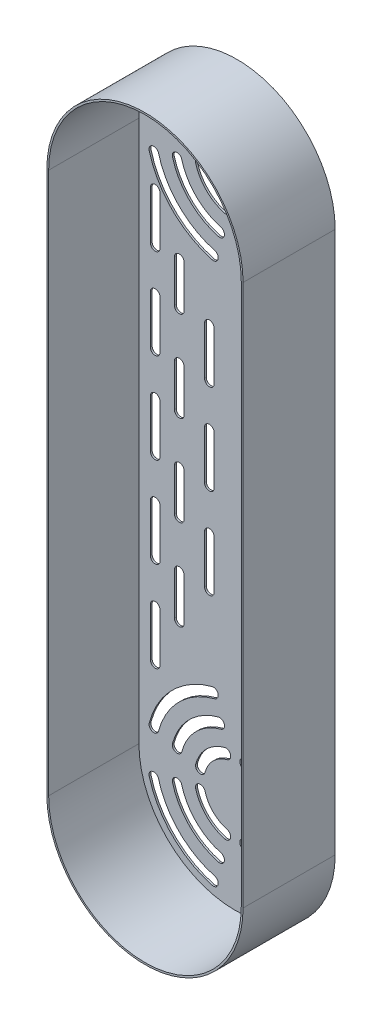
SolidWorks part; units mm, degrees
ref_plane "Front Plane" through (0, 0, 0) normal (0, 0, 1) x (1, 0, 0)
ref_plane "Top Plane" through (0, 0, 0) normal (0, 1, 0) x (1, 0, 0)
ref_plane "Right Plane" through (0, 0, 0) normal (1, 0, 0) x (0, 0, -1)
sketch "Sketch1" plane through (0, 0, 0) normal (0, 0, 1) x (1, 0, 0)
  line L0 (-163, 0) -> (163, 0) construction
  line L1 (-160, 900) -> (-160, 0)
  line L2 (160, 900) -> (160, 0)
  line L3 (-163, 900) -> (-163, 0)
  line L4 (163, 900) -> (163, 0)
  line L5 (163, 900) -> (-163, 900) construction
  line L6 (0, 900) -> (0, 0) construction
  arc A0 (163, 900) -> (-163, 900) centre (0, 900) ccw
  arc A1 (-160, 0) -> (160, 0) centre (0, 0) ccw
  arc A2 (160, 900) -> (-160, 900) centre (0, 900) ccw
  arc A3 (-163, 0) -> (163, 0) centre (0, 0) ccw
  dimension "D1" = 3
  dimension "D2" = 900
  dimension "D3" = 160
extrude "Boss-Extrude1" add sketch "Sketch1" along normal blind 150 contours L3 A3 L4 A0 | A1 L2 A2 L1
sketch "Sketch2" plane through (0, 0, 0) normal (0, 0, -1) x (-1, 0, 0)
  line L0 (0, 0) -> (-163, 0) construction
  line L1 (0, 900) -> (-163, 900) construction
  line L2 (-163, 0) -> (-163, 900)
  line L3 (0, 0) -> (0, 900) construction
  line L4 (163, 0) -> (163, 900)
  arc A0 (-163, 0) -> (163, 0) centre (0, 0) ccw
  arc A1 (163, 900) -> (-163, 900) centre (0, 900) ccw
  arc A2 (163, 900) -> (-163, 900) centre (0, 900) ccw construction
  arc A3 (-163, 0) -> (163, 0) centre (0, 0) ccw construction
extrude "Boss-Extrude2" add sketch "Sketch2" along normal blind 3
sketch "Sketch3" plane through (0, 0, 0) normal (0, 0, 1) x (1, 0, 0)
  line L0 (135.2296, -36.2347) -> (0, 0) construction
  line L1 (36.2347, -135.2296) -> (0, 0) construction
  line L2 (55, 0) -> (-55, 0) construction
  line L3 (0, -55) -> (0, 55) construction
  arc A0 (135.2296, -36.2347) -> (36.2347, -135.2296) centre (0, 0) cw construction
  arc A1 (38.3052, -142.957) -> (142.957, -38.3052) centre (0, 0) ccw
  arc A2 (34.1641, -127.5022) -> (127.5022, -34.1641) centre (0, 0) ccw
  arc A3 (34.1641, -127.5022) -> (38.3052, -142.957) centre (36.2347, -135.2296) ccw
  arc A4 (142.957, -38.3052) -> (127.5022, -34.1641) centre (135.2296, -36.2347) ccw
  arc A5 (25.8819, -96.5926) -> (96.5926, -25.8819) centre (0, 0) ccw construction
  arc A6 (27.9525, -104.32) -> (104.32, -27.9525) centre (0, 0) ccw
  arc A7 (23.8114, -88.8652) -> (88.8652, -23.8114) centre (0, 0) ccw
  arc A8 (23.8114, -88.8652) -> (27.9525, -104.32) centre (25.8819, -96.5926) ccw
  arc A9 (104.32, -27.9525) -> (88.8652, -23.8114) centre (96.5926, -25.8819) ccw
  arc A10 (57.9555, -15.5291) -> (15.5291, -57.9555) centre (0, 0) cw construction
  arc A11 (17.5997, -65.683) -> (65.683, -17.5997) centre (0, 0) ccw
  arc A12 (13.4586, -50.2281) -> (50.2281, -13.4586) centre (0, 0) ccw
  arc A13 (13.4586, -50.2281) -> (17.5997, -65.683) centre (15.5291, -57.9555) ccw
  arc A14 (65.683, -17.5997) -> (50.2281, -13.4586) centre (57.9555, -15.5291) ccw
  point P4 (98.9949, -98.9949)
  point P9 (70.7107, -70.7107)
  point P22 (42.4264, -42.4264)
  dimension "D1" = 140
  dimension "D2" = 100
  dimension "D3" = 60
  dimension "D4" = 8
  dimension "D5" = 15
  dimension "D6" = 15
extrude "Cut-Extrude1" cut sketch "Sketch3" against normal blind 10 contours A6 A9 A7 A8 | A1 A4 A2 A3 | A11 A14 A12 A13
pattern_circular "CirPattern1" count 4 over 360 about axis through (0, 0, 0) along (0, 0, 1) of "Cut-Extrude1"
pattern_linear "LPattern1" count 2 spacing 900 along (0, 1, 0) of "CirPattern1", "Cut-Extrude1"
sketch "Sketch4" plane through (0, 0, -3) normal (0, 0, -1) x (-1, 0, 0)
  line L0 (-133, 130) -> (-133, 210) construction
  line L1 (-141, 130) -> (-141, 210)
  line L2 (-125, 130) -> (-125, 210)
  line L4 (-163, 900) -> (-163, 0) construction
  line L5 (84.15, 0) -> (-84.15, 0) construction
  arc A0 (-141, 130) -> (-125, 130) centre (-133, 130) ccw
  arc A1 (-125, 210) -> (-141, 210) centre (-133, 210) ccw
  point P2 (-133, 170)
  dimension "D2" = 80
  dimension "D4" = 8
  dimension "D1" = 30
  dimension "D3" = 170
extrude "Cut-Extrude2" cut sketch "Sketch4" against normal blind 10
pattern_linear "LPattern2" count 5 spacing 150 along (0, 1, 0) of "Cut-Extrude2"
sketch "Sketch5" plane through (0, 0, -3) normal (0, 0, -1) x (-1, 0, 0)
  line L0 (-93, 210) -> (-93, 280) construction
  line L1 (-101, 210) -> (-101, 280)
  line L2 (-85, 210) -> (-85, 280)
  line L3 (-133, 210) -> (-93, 210) construction
  line L4 (-93, 280) -> (-133, 280) construction
  arc A0 (-101, 210) -> (-85, 210) centre (-93, 210) ccw
  arc A1 (-85, 280) -> (-101, 280) centre (-93, 280) ccw
  point P2 (-93, 245)
  dimension "D1" = 8
  dimension "D2" = 40
extrude "Cut-Extrude3" cut sketch "Sketch5" against normal blind 10
pattern_linear "LPattern3" count 4 spacing 150 along (0, 1, 0) of "Cut-Extrude3"
sketch "Sketch6" plane through (0, 0, -3) normal (0, 0, -1) x (-1, 0, 0)
  line L0 (-43, 360) -> (-43, 280) construction
  line L1 (-35, 360) -> (-35, 280)
  line L2 (-51, 360) -> (-51, 280)
  line L3 (-93, 360) -> (-43, 360) construction
  line L4 (-93, 280) -> (-43, 280) construction
  arc A0 (-35, 360) -> (-51, 360) centre (-43, 360) ccw
  arc A1 (-51, 280) -> (-35, 280) centre (-43, 280) ccw
  point P2 (-43, 320)
  dimension "D1" = 8
  dimension "D2" = 50
extrude "Cut-Extrude4" cut sketch "Sketch6" against normal blind 10
pattern_linear "LPattern4" count 3 spacing 150 along (0, 1, 0) of "Cut-Extrude4"
mirror "Mirror1" about plane through (0, 0, 0) normal (1, 0, 0) of "LPattern4", "LPattern3", "LPattern2", "Cut-Extrude2", "Cut-Extrude4", "Cut-Extrude3"
